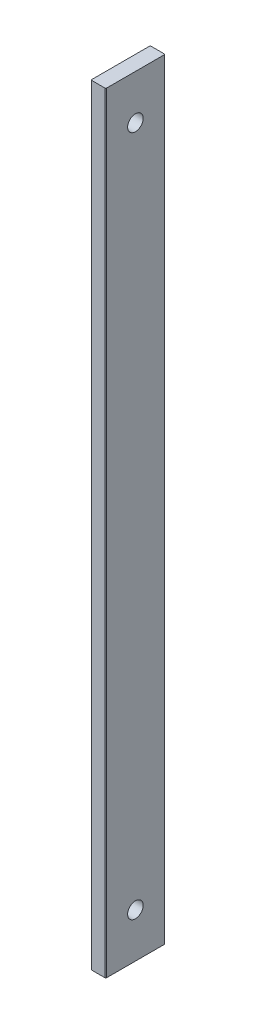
SolidWorks part; units mm, degrees
ref_plane "Plan de face" through (0, 0, 0) normal (0, 0, 1) x (1, 0, 0)
ref_plane "Plan de dessus" through (0, 0, 0) normal (0, 1, 0) x (1, 0, 0)
ref_plane "Plan de droite" through (0, 0, 0) normal (1, 0, 0) x (0, 0, -1)
ref_plane "Plan1" through (-5, 0, 0) normal (-1, 0, 0) x (0, -1, 0)
sketch "Esquisse1" plane through (-5, 0, 0) normal (-1, 0, 0) x (0, -1, 0)
  line L0 (-260, 20) -> (-260, -20)
  line L1 (-260, -20) -> (260, -20)
  line L2 (260, -20) -> (260, 20)
  line L3 (260, 20) -> (-260, 20)
extrude "Boss.-Extru.1" add sketch "Esquisse1" against normal blind 10
hole_wizard "Diamètre du perçage Ø10.5 (10.5)1" positions "Esquisse3" profile "Esquisse2" hole size "Ø10.5" standard "Ansi Metric"
sketch "Esquisse3" plane through (-5, 0, 0) normal (-1, 0, 0) x (0, 0, 1)
  point P0 (0, -230)
sketch "Esquisse2" plane through (-5, -230, 0) normal (0, 1, 0) x (0, 0, 1)
  line L0 (0, 0) -> (0, 10)
  line L1 (0, 10) -> (5.25, 10)
  line L2 (5.25, 10) -> (5.25, 0)
  line L5 (5.25, 0) -> (0, 0)
  line L11 (0, -6.35) -> (0, 107.95) construction
  dimension "Diamètre du perçage jusqu'au prochain" = 10.5
  dimension "Profondeur du perçage jusqu'au prochain" = 10
hole_wizard "Diamètre du perçage Ø10.5 (10.5)2" positions "Esquisse5" profile "Esquisse4" hole size "Ø10.5" standard "Ansi Metric"
sketch "Esquisse5" plane through (5, 0, 0) normal (1, 0, 0) x (0, 0, -1)
  point P0 (0, 230)
sketch "Esquisse4" plane through (5, 230, 0) normal (0, 1, 0) x (0, 0, -1)
  line L0 (0, 0) -> (0, 10)
  line L1 (0, 10) -> (5.25, 10)
  line L2 (5.25, 10) -> (5.25, 0)
  line L5 (5.25, 0) -> (0, 0)
  line L11 (0, -6.35) -> (0, 107.95) construction
  dimension "Diamètre du perçage jusqu'au prochain" = 10.5
  dimension "Profondeur du perçage jusqu'au prochain" = 10
fillet "Congé1" radius 0.5 4 edges at (5, 0, 20) (5, 0, -20) (-5, 0, 20) (-5, 0, -20)
